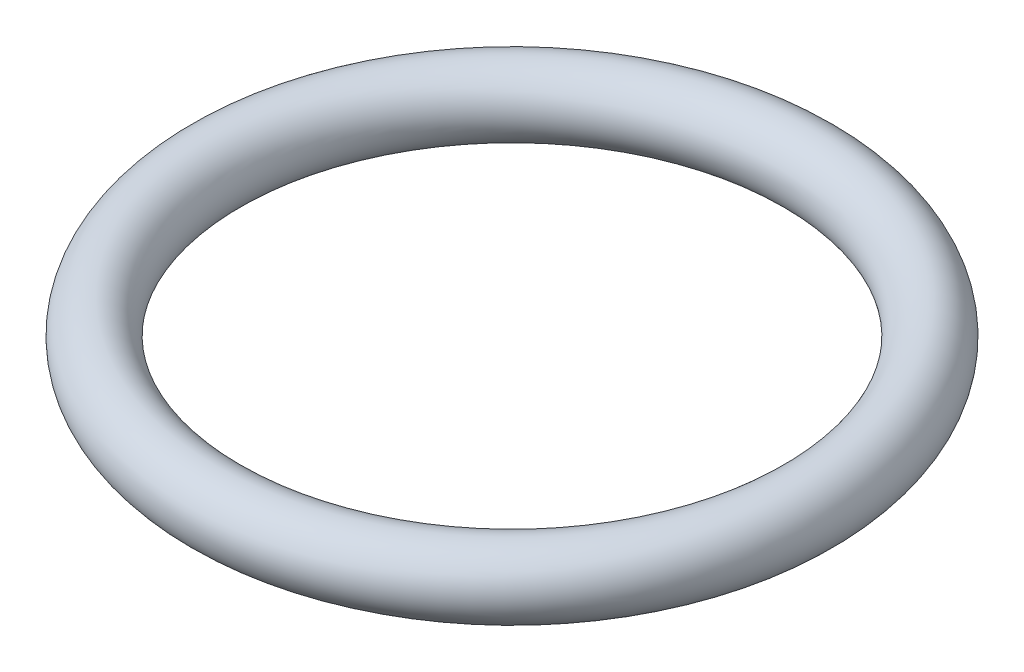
SolidWorks part; units mm, degrees
ref_plane "Face" through (0, 0, 0) normal (0, 0, 1) x (1, 0, 0)
ref_plane "Dessus" through (0, 0, 0) normal (0, 1, 0) x (1, 0, 0)
ref_plane "Droite" through (0, 0, 0) normal (1, 0, 0) x (0, 0, -1)
sketch "Esquisse1" plane through (0, 0, 0) normal (0, 0, 1) x (1, 0, 0)
  line L0 (0, 0) -> (0, -2.8988) construction
  circle A0 centre (5.65, 1.3) radius 0.65
  dimension "D1" = 1.3
  dimension "D2" = 10
revolve "Révolution1" add sketch "Esquisse1" angle 360 about L0
